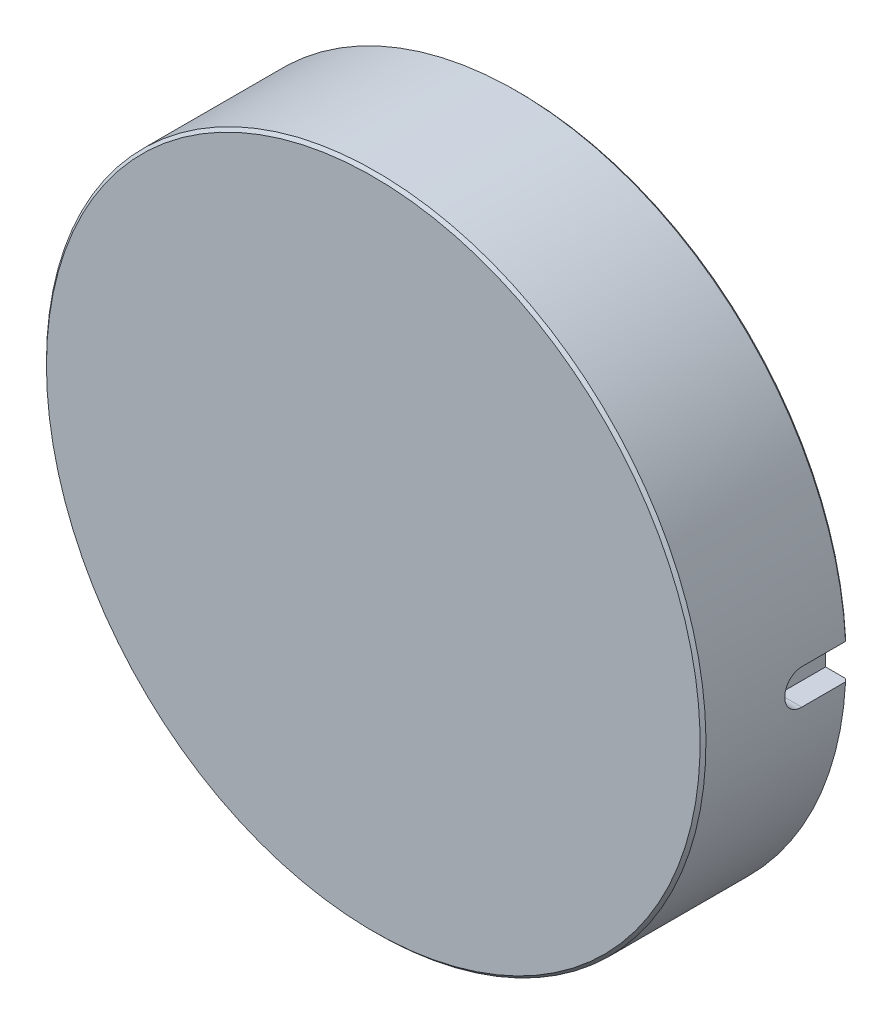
SolidWorks part; units mm, degrees
ref_plane "前视基准面" through (0, 0, 0) normal (0, 0, 1) x (1, 0, 0)
ref_plane "上视基准面" through (0, 0, 0) normal (0, 1, 0) x (1, 0, 0)
ref_plane "右视基准面" through (0, 0, 0) normal (1, 0, 0) x (0, 0, -1)
imported_body "AIR50 - 机械接口-1-solid1"
sketch "草图1" plane through (0, 0, 0) normal (0, 0, 1) x (1, 0, 0)
  circle A0 centre (0, 0) radius 54.6456
extrude "凸台-拉伸1" add sketch "草图1" against normal blind 13
